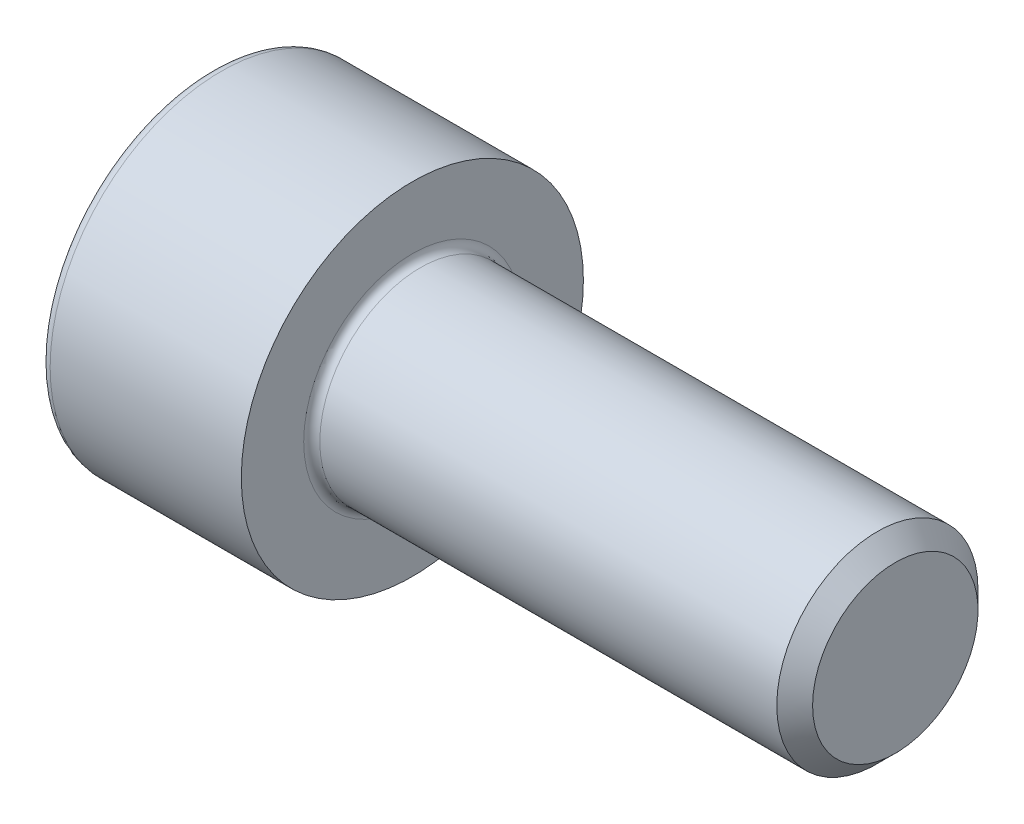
SolidWorks part; units mm, degrees
revolve "Base-Revolve" add sketch "BodySke"
sketch "BodySke" plane through (0, 0, 0) normal (0, 0, 1) x (1, 0, 0)
  line L0 (0, 0) -> (0, 4.25)
  line L1 (0, 4.25) -> (5, 4.25)
  line L2 (5, 4.25) -> (5, 2.5)
  line L3 (5, 2.5) -> (16.555, 2.5)
  line L4 (17, 2.055) -> (17, 0)
  line L5 (17, 0) -> (0, 0)
  line L6 (-31.75, 0) -> (127, 0) construction
  line L8 (17, 2.055) -> (16.555, 2.5)
  line L10 (17, -2.055) -> (16.555, -2.5) construction
  line L11 (5.8, 9.525) -> (5.8, 3.175) construction
  line L12 (5, 9.525) -> (5, 3.175) construction
  line L13 (-43, 9.525) -> (-43, 3.175) construction
fillet "Fillet1" radius 0.2 1 edges at (5, 0, 2.5)
fillet "Fillet2" radius 0.25 1 edges at (0, 0, 4.25)
ref_plane "Plane1" through (0, 0, 0) normal (0, 0, 1) x (1, 0, 0)
ref_plane "Plane2" through (0, 0, 0) normal (0, 1, 0) x (1, 0, 0)
ref_plane "Plane3" through (0, 0, 0) normal (1, 0, 0) x (0, 0, -1)
other "Configuration Table"
sketch "Sketch2" plane through (0, 0, 0) normal (0, 0, 1) x (1, 0, 0)
  line L0 (0, 2.042) -> (2.5, 2.042)
  line L1 (2.5, 2.042) -> (3.6789, 0)
  line L2 (-31.75, 0) -> (127, 0) construction
  line L3 (3.6789, 0) -> (0, 0)
  line L4 (0, 0) -> (0, 2.042)
  line L6 (0, 0) -> (47.625, 0) construction
revolve "Hex-PreBroach" cut sketch "Sketch2" angle 360 about L6
sketch "Sketch3" plane through (0, 0, 0) normal (-1, 0, 0) x (0, 0.5, 0.866)
  line L0 (1.1789, 2.042) -> (-1.1789, 2.042)
  line L1 (-1.1789, 2.042) -> (-2.3579, 0)
  line L2 (1.1789, 2.042) -> (2.3579, 0)
  line L3 (1.1789, -2.042) -> (2.3579, 0)
  line L4 (1.1789, -2.042) -> (-1.1789, -2.042)
  line L5 (-1.1789, -2.042) -> (-2.3579, 0)
extrude "Hex" cut sketch "Sketch3" against normal blind 2.5
sketch "ThdSchSke" plane through (0, 0, 0) normal (0, 0, 1) x (1, 0, 0)
  line L0 (7.4, -2.055) -> (7.0884, -2.5)
  line L1 (7.4, -2.055) -> (7.7116, -2.5)
  line L2 (7.7116, -2.5) -> (7.7116, -3.125)
  line L3 (-3.175, 0) -> (5.1513, 0) construction
  line L4 (0, 4) -> (0, -4) construction
  line L5 (7.7116, -3.125) -> (7.0884, -3.125)
  line L6 (7.0884, -3.125) -> (7.0884, -2.5)
revolve "ThreadSchematic" [suppressed] cut sketch "ThdSchSke" angle 360 about L3
pattern_linear "ThdSchPat" [suppressed]
equation "\"D2@Sketch3\" = \"Hex_size@Sketch3\" / 2"
equation "\"D1@Sketch3\" = \"Hex_size@Sketch3\" / 2"
equation "\"D1@Sketch2\" = \"Hex_size@Sketch3\" / 2"
equation "\"Thread_minor@ThreadCosmetic\"  =  \"Minor_dia@BodySke\""
equation "\"Depth@Sketch2\" =  \"Key_eng@Hex\""
equation "\"Thread_length@ThreadCosmetic\" = ((sgn( (\"Length@BodySke\" - \"Advance@BodySke\" * 3.0) - \"Thread_nom@BodySke\" )-1)*( (\"Length@BodySke\" - \"Advance@BodySke\" * 3.0) - \"Thread_nom@BodySke\" ))/-2+ \"Thread_no"
equation "\"Thread_minor@ThdSchSke\" = \"Minor_dia@BodySke\""
equation "\"Diameter@ThdSchSke\" = \"Diameter@BodySke\""
equation "\"Overcut@ThdSchSke\" = \"Diameter@BodySke\" * 1.25"
equation "\"Start@ThdSchSke\" = \"Head_ht@BodySke\" + \"Length@BodySke\" - \"Thread_length@ThreadCosmetic\"  '---Non-countersunk---"
equation "\"Num_threads@ThdSchPat\" = int( \"Thread_length@ThreadCosmetic\" / \"Advance@BodySke\" + 0.999 )  + 1"
equation "\"Advance@ThdSchPat\" = \"Thread_length@ThreadCosmetic\" /  (\"Num_threads@ThdSchPat\" - 1) 'relax it"
equation "\"Num_threads@ThdSchPat\" = \"Num_threads@ThdSchPat\" - sgn( \"Num_threads@ThdSchPat\" - 1) '---chamfered tips only---"
